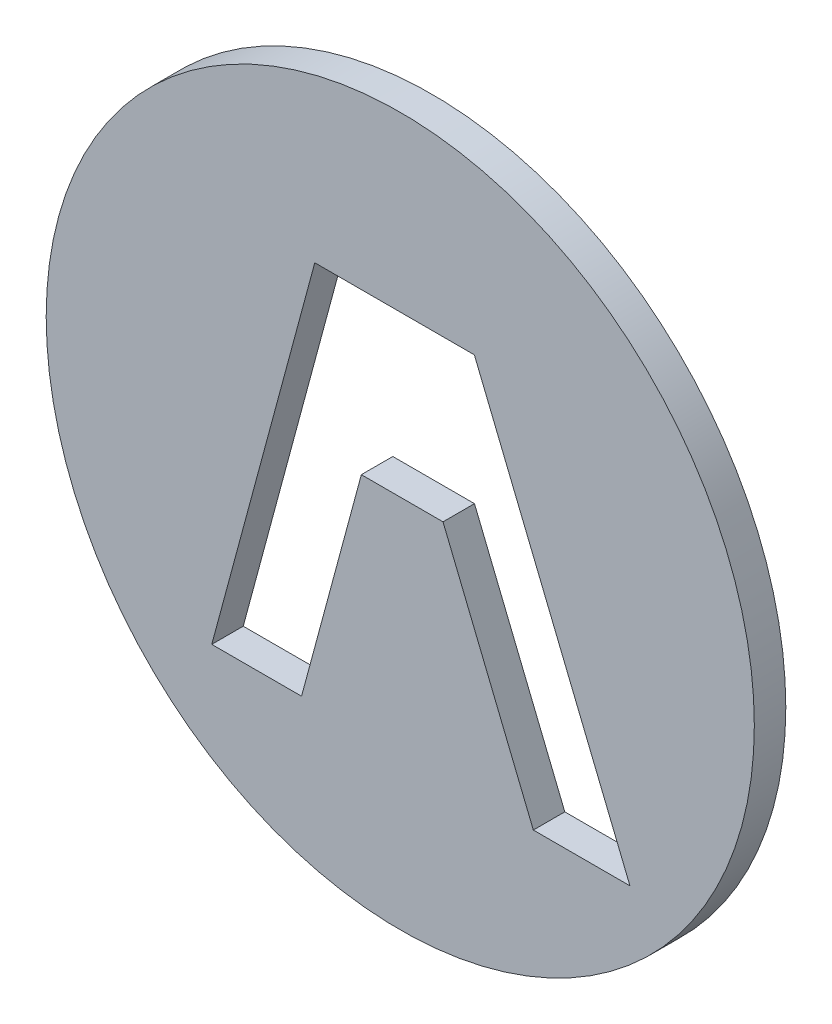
SolidWorks part; units mm, degrees
ref_plane "Front Plane" through (0, 0, 0) normal (0, 0, 1) x (1, 0, 0)
ref_plane "Top Plane" through (0, 0, 0) normal (0, 1, 0) x (1, 0, 0)
ref_plane "Right Plane" through (0, 0, 0) normal (1, 0, 0) x (0, 0, -1)
sketch "Sketch1" plane through (0, 0, 0) normal (0, 0, 1) x (1, 0, 0)
  circle A0 centre (0, -3.4735) radius 45
  dimension "D1" = 90
extrude "Boss-Extrude1" add sketch "Sketch1" along normal blind 4
sketch "Sketch2" plane through (0, 0, 4) normal (0, 0, 1) x (1, 0, 0)
  line L0 (-10.8637, 19.5298) -> (-23.9564, -29.0226)
  line L1 (-23.9564, -29.0226) -> (-12.5472, -29.0226)
  line L2 (-12.5472, -29.0226) -> (-4.9466, -0.8367)
  line L3 (-4.9466, -0.8367) -> (5.432, -0.8367)
  line L4 (5.432, -0.8367) -> (16.9115, -29.0226)
  line L5 (16.9115, -29.0226) -> (29.1917, -29.0226)
  line L6 (29.1917, -29.0226) -> (9.4174, 19.5298)
  line L7 (9.4174, 19.5298) -> (-10.8637, 19.5298)
extrude "Cut-Extrude1" cut sketch "Sketch2" against normal blind 4
